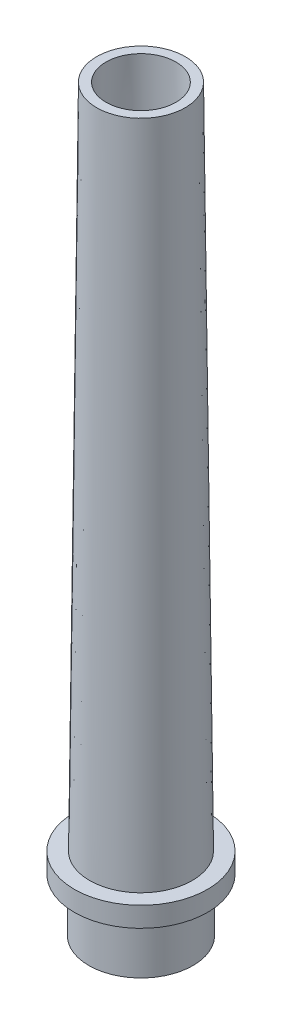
SolidWorks part; units mm, degrees
ref_plane "Спереди" through (0, 0, 0) normal (0, 0, 1) x (1, 0, 0)
ref_plane "Сверху" through (0, 0, 0) normal (0, 1, 0) x (1, 0, 0)
ref_plane "Справа" through (0, 0, 0) normal (1, 0, 0) x (0, 0, -1)
sketch "Эскиз1" plane through (0, 0, 0) normal (0, 1, 0) x (1, 0, 0)
  circle A0 centre (0, 0) radius 6.125
  circle A1 centre (0, 0) radius 7.825
  dimension "D1" = 12.25
  dimension "D2" = 15.65
ref_plane "Плоскость1" through (0, 111, 0) normal (0, 1, 0) x (1, 0, 0)
sketch "Эскиз2" plane through (0, 111, 0) normal (0, 1, 0) x (1, 0, 0)
  circle A0 centre (0, 0) radius 5.25
  circle A1 centre (0, 0) radius 6.65
  dimension "D1" = 10.5
  dimension "D2" = 13.3
sketch "Эскиз3" plane through (0, 0, 0) normal (0, 0, 1) x (1, 0, 0)
  line L0 (7.825, 0) -> (6.65, 111)
  line L1 (7.825, 0) -> (-7.825, 0) construction
  line L2 (6.65, 111) -> (-6.65, 111) construction
  line L3 (6.65, 111) -> (5.25, 111)
  line L4 (5.25, 111) -> (-5.25, 111) construction
  line L5 (5.25, 111) -> (6.125, 0)
  line L6 (6.125, 0) -> (-6.125, 0) construction
  line L7 (6.125, 0) -> (7.825, 0)
  line L8 (0, 122.7866) -> (0, -6.7138) construction
revolve "Повернуть1" add sketch "Эскиз3" angle 360 about L8
sketch "Эскиз4" plane through (0, 0, 0) normal (0, -1, 0) x (1, 0, 0)
  circle A0 centre (0, 0) radius 7.825
  circle A1 centre (0, 0) radius 6.125
extrude "Бобышка-Вытянуть1" add sketch "Эскиз4" against normal blind 8
sketch "Эскиз5" plane through (0, 8, 0) normal (0, 1, 0) x (1, 0, 0)
  circle A0 centre (0, 0) radius 10
  circle A1 centre (0, 0) radius 6.86
  dimension "D1" = 20
extrude "Бобышка-Вытянуть2" add sketch "Эскиз5" along normal blind 3
